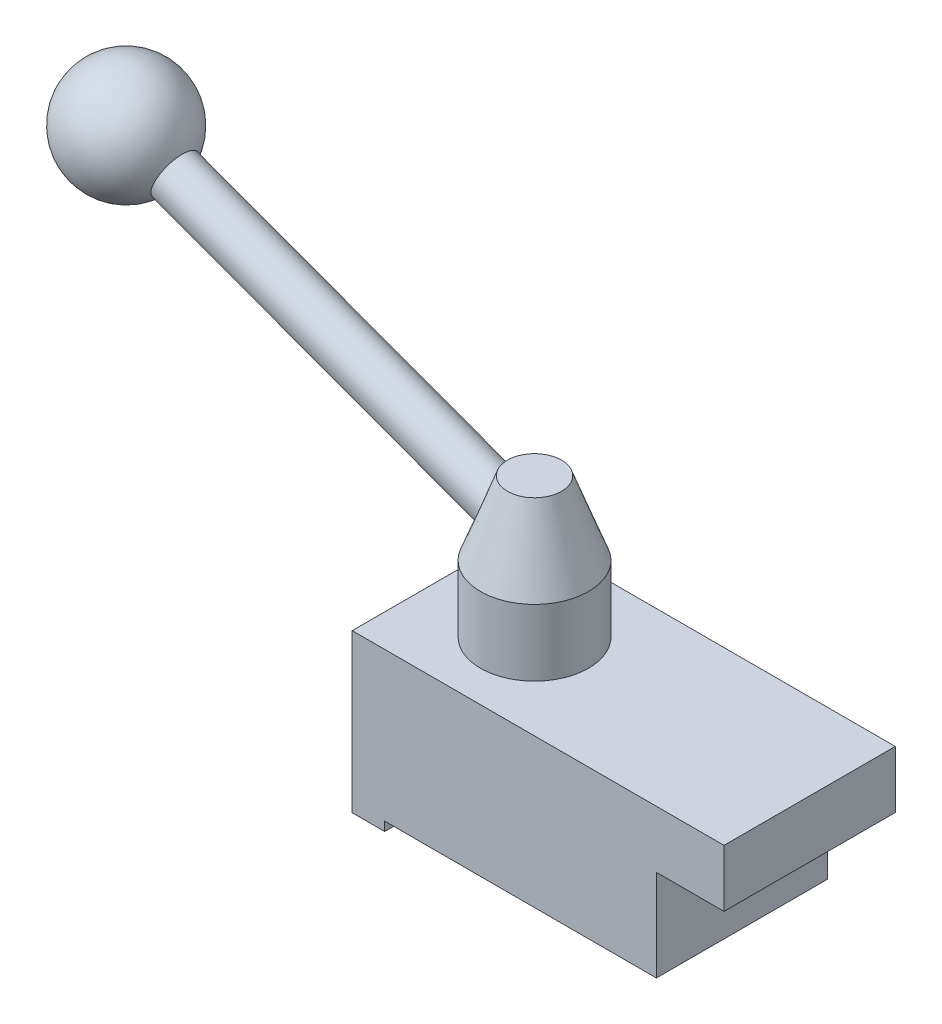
SolidWorks part; units mm, degrees
ref_plane "Plan1" through (0, 0, 0) normal (0, 0, 1) x (1, 0, 0)
ref_plane "Plan2" through (0, 0, 0) normal (0, 1, 0) x (1, 0, 0)
ref_plane "Plan3" through (0, 0, 0) normal (1, 0, 0) x (0, 0, -1)
sketch "Esquisse1" plane through (0, 0, 0) normal (0, 0, 1) x (1, 0, 0)
  line L0 (-127.5, 0) -> (-120.2906, 0)
  line L1 (-120.2906, 0) -> (-120.2906, 2)
  line L2 (-120.2906, 2) -> (-60, 2)
  line L3 (-60, 2) -> (-60, 22.3)
  line L4 (-60, 22.3) -> (-45, 22.3)
  line L5 (-45, 22.3) -> (-45, 35)
  line L6 (-45, 35) -> (-127.5, 35)
  line L7 (-127.5, 35) -> (-127.5, 0)
  line L9 (0, -50) -> (0, 50) construction
  dimension "D1" = 82.5
  dimension "D2" = 35
  dimension "D3" = 45
  dimension "D4" = 22.3
  dimension "D5" = 2
  dimension "D6" = 7.2094
  dimension "D7" = 60
extrude "Boss.-Extru.1" add sketch "Esquisse1" along normal mid plane 38
sketch "Esquisse2" plane through (0, 0, 0) normal (0, 0, 1) x (1, 0, 0)
  line L0 (-106.0469, -18.1625) -> (-106.0469, 81.018) construction
  line L1 (-106.0469, 35) -> (-118.0469, 35)
  line L2 (-118.0469, 35) -> (-118.0469, 49.7455)
  line L3 (-118.0469, 49.7455) -> (-112.0469, 66)
  line L4 (-112.0469, 66) -> (-106.0469, 66)
  line L5 (-106.0469, 66) -> (-106.0469, 35)
  line L6 (-45, 35) -> (-127.5, 35) construction
  line L7 (-127.5, 35) -> (-127.5, 0) construction
  line L8 (-113.3155, 62.5634) -> (-184.185, 88.7234) construction
  line L9 (-115.0469, 57.8728) -> (-266.6647, 113.8393) construction
  line L10 (-266.6647, 113.8393) -> (-264.9333, 118.5299) construction
  line L11 (-127.5, 0) -> (-120.2906, 0) construction
  arc A0 (-184.185, 88.7234) -> (-208.3906, 92.3286) centre (-196.664, 88) ccw construction
  dimension "D7" = 12.5
  dimension "D6" = 87
  dimension "D5" = 88
  dimension "D1" = 21.4531
  dimension "D2" = 24
  dimension "D3" = 31
  dimension "D4" = 5
  dimension "D8" = 20.261
  dimension "D9" = 12
revolve "Révolution1" add sketch "Esquisse2" angle 360 about L0
sketch "Esquisse3" plane through (0, 0, 0) normal (0, 0, 1) x (1, 0, 0)
  line L0 (-115.0469, 57.8728) -> (-266.6647, 113.8393) construction
  line L1 (-110.8662, 56.3295) -> (-208.3906, 92.3286)
  line L2 (-113.3155, 62.5634) -> (-184.185, 88.7234) construction
  line L4 (-109.1348, 61.0202) -> (-184.185, 88.7234)
  line L5 (-110.8662, 56.3295) -> (-109.1348, 61.0202)
  line L6 (-110.8662, 56.3295) -> (-266.6647, 113.8393) construction
  arc A0 (-184.185, 88.7234) -> (-208.3906, 92.3286) centre (-196.664, 88) ccw construction
  arc A1 (-184.185, 88.7234) -> (-208.3906, 92.3286) centre (-196.664, 88) ccw
  dimension "D1" = 80
revolve "Révolution2" add sketch "Esquisse3" angle 360 about L6
